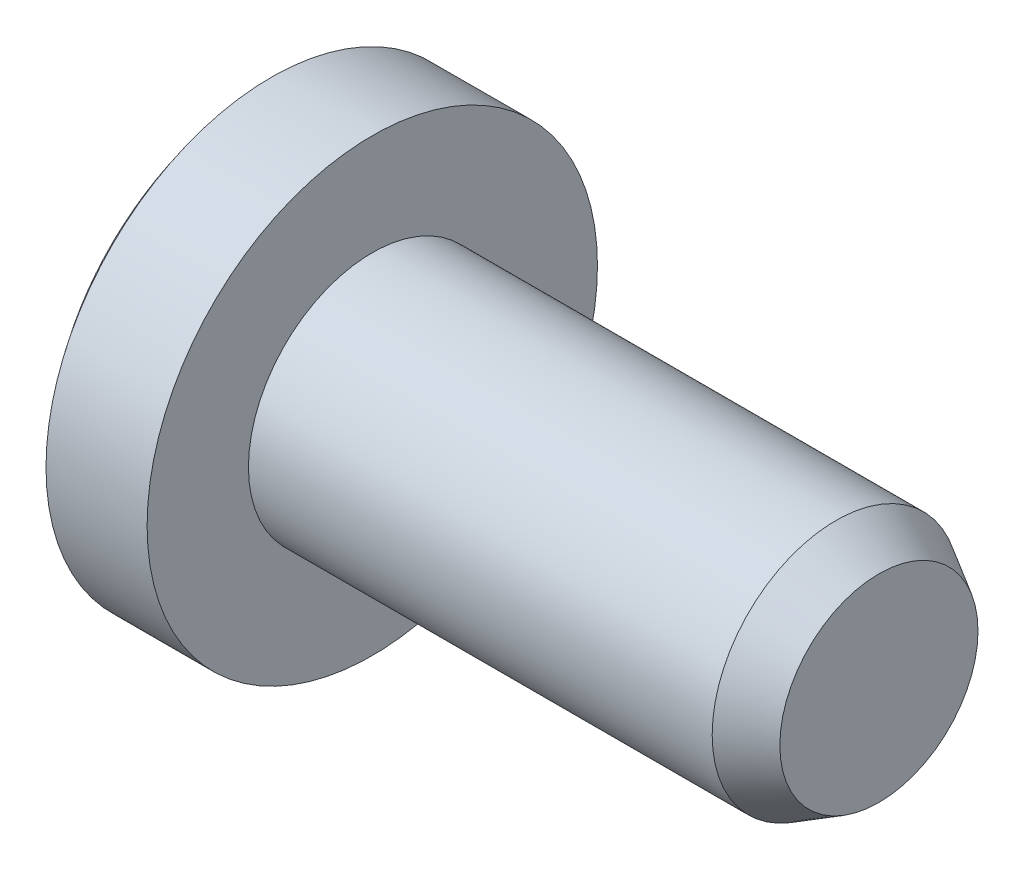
SolidWorks part; units mm, degrees
ref_plane "Front Plane" through (0, 0, 0) normal (0, 0, 1) x (1, 0, 0)
ref_plane "Top Plane" through (0, 0, 0) normal (0, 1, 0) x (1, 0, 0)
ref_plane "Right Plane" through (0, 0, 0) normal (1, 0, 0) x (0, 0, -1)
sketch "Sketch1" plane through (0, 0, 0) normal (0, 0, 1) x (1, 0, 0)
  line L0 (0, 0) -> (5.2282, 0) construction
  line L2 (0, 2) -> (-0.898, 2)
  line L3 (-1.6, 0) -> (-1.6, -0.7496) construction
  line L4 (-1.6, 0) -> (4.5, 0)
  line L5 (0, 1.1) -> (4.5, 1.1)
  line L6 (4.5, 1.1) -> (4.5, 0)
  line L7 (0, 1.1) -> (0, 2)
  arc A0 (-0.898, 2) -> (-1.6, 0) centre (1.6, 0) ccw
  dimension "rf" = 3.2
  dimension "Dk" = 4
  dimension "K" = 1.6
  dimension "l" = 4.5
  dimension "d" = 2.2
revolve "Revolve1" add sketch "Sketch1" angle 360 about L0
chamfer "Chamfer1" distance 0.22 angle 60 1 edges at (4.5, 0, 1.1)
sketch "Sketch5" plane through (0, 0, 0) normal (0, 0, 1) x (1, 0, 0)
  line L0 (0.3703, 0.825) -> (0.2069, 0.825)
  line L1 (0.2069, 0.825) -> (0.0481, 1.1)
  line L2 (0.3703, 0.825) -> (0.529, 1.1)
  line L3 (0.0481, 1.1) -> (0.0481, 1.35)
  line L4 (0.529, 1.1) -> (0.529, 1.35)
  line L5 (0.0481, 1.35) -> (0.529, 1.35)
  line L6 (0.2886, 0.825) -> (0.2886, 0) construction
  line L7 (0, 0) -> (7.3035, 0) construction
  line L9 (4.1189, 1.1) -> (0, 1.1) construction
  line L12 (0, -1.1) -> (0, 1.1) construction
  dimension "D2" = 60
  dimension "D3" = 0.25
  dimension "threadstart" = 0.2886
  dimension "minordia" = 1.65
  dimension "advance" = 0.4809
revolve "ThreadSchematic" [suppressed] cut sketch "Sketch5" angle 360 about L7
pattern_linear "ThdSchPat" [suppressed] count 10 spacing 0.4809 along (1, 0, 0)
sketch "Sketch2" plane through (0, 0, 0) normal (0, 0, 1) x (1, 0, 0)
  line L0 (0, 0) -> (5.7679, 0) construction
  line L1 (4.5, 0) -> (2.5947, 1.1)
  line L3 (4.5, 1.1) -> (4.5, 0) construction
  line L4 (2.5947, 1.1) -> (2.5947, 1.2)
  line L5 (2.5947, 1.2) -> (4.6, 1.2)
  line L6 (4.6, 1.2) -> (4.6, 0)
  line L7 (4.6, 0) -> (4.5, 0)
  point P9 (0, 1.1)
  dimension "D1" = 30
  dimension "D2" = 0.1
  dimension "D3" = 0.1
revolve "EndCone" [suppressed] cut sketch "Sketch2" angle 360 about L0
ref_plane "Plane4" through (-1.6, 0, 0) normal (1, 0, 0) x (0, 0, -1)
sketch "Sketch3" plane through (-1.6, 0, 0) normal (1, 0, 0) x (0, 0, -1)
  line L0 (0, 2.343) -> (0, -2.4842) construction
  line L1 (2.7661, 0) -> (-3.4558, 0) construction
  line L2 (-0.2375, 0.95) -> (0.2375, 0.95)
  line L3 (0.2375, 0.95) -> (0.1425, 0.57)
  line L4 (0, 0) -> (1.9578, 1.9578) construction
  line L5 (0.1425, 0.57) -> (0.299, 0.299)
  line L6 (0.1425, 0.57) -> (0, 0) construction
  line L7 (-0.1425, 0.57) -> (-0.299, 0.299)
  line L8 (-0.2375, 0.95) -> (-0.1425, 0.57)
  line L9 (0.95, 0.2375) -> (0.95, -0.2375)
  line L10 (0.95, -0.2375) -> (0.57, -0.1425)
  line L11 (0.57, -0.1425) -> (0.299, -0.299)
  line L12 (0.57, 0.1425) -> (0.299, 0.299)
  line L13 (0.95, 0.2375) -> (0.57, 0.1425)
  line L14 (0.2375, -0.95) -> (-0.2375, -0.95)
  line L15 (-0.2375, -0.95) -> (-0.1425, -0.57)
  line L16 (-0.1425, -0.57) -> (-0.299, -0.299)
  line L17 (0.1425, -0.57) -> (0.299, -0.299)
  line L18 (0.2375, -0.95) -> (0.1425, -0.57)
  line L19 (-0.95, -0.2375) -> (-0.95, 0.2375)
  line L20 (-0.95, 0.2375) -> (-0.57, 0.1425)
  line L21 (-0.57, 0.1425) -> (-0.299, 0.299)
  line L22 (-0.57, -0.1425) -> (-0.299, -0.299)
  line L23 (-0.95, -0.2375) -> (-0.57, -0.1425)
  point P14 (0, 0.95)
  point P23 (0.95, 0)
  point P30 (0, -0.95)
  point P37 (-0.95, 0)
  dimension "D1" = 45
  dimension "m" = 1.9
  dimension "D3" = 0.475
  dimension "D4" = 75
  dimension "D5" = 1.14
extrude "Cut-Extrude1" cut sketch "Sketch3" along normal blind 0.8 draft 6
sketch "Sketch4" plane through (-1.6, 0, 0) normal (1, 0, 0) x (0, 0, -1)
  line L0 (0, 2.1951) -> (0, -2.1951) construction
  line L1 (2.1996, 0) -> (-2.3835, 0) construction
  line L2 (-0.8397, -0.8397) -> (0.8397, 0.8397) construction
  line L3 (0.95, 0.2375) -> (-0.95, 0.2375)
  line L4 (0.95, 0.2375) -> (0.95, -0.2375)
  line L5 (0.95, -0.2375) -> (-0.95, -0.2375)
  line L6 (-0.95, 0.2375) -> (-0.95, -0.2375)
  line L7 (0.2375, 0.95) -> (-0.2375, 0.95)
  line L8 (0.2375, 0.95) -> (0.2375, -0.95)
  line L9 (0.2375, -0.95) -> (-0.2375, -0.95)
  line L10 (-0.2375, 0.95) -> (-0.2375, -0.95)
  line L11 (0.8397, 0.8397) -> (0.3859, 0.2375)
  line L12 (0.8397, 0.8397) -> (0.2375, 0.3859)
  line L13 (0.2375, 0.3859) -> (-0.2375, 0.3859) construction
  line L14 (0, 0) -> (-0.8397, 0.8397) construction
  line L15 (-0.8397, -0.8397) -> (-0.2375, -0.3859)
  line L16 (-0.8397, -0.8397) -> (-0.3859, -0.2375)
  line L17 (-0.2375, 0.3859) -> (-0.8397, 0.8397)
  line L18 (-0.8397, 0.8397) -> (-0.3859, 0.2375)
  line L19 (-0.3859, -0.2375) -> (-0.3859, 0.2375) construction
  line L20 (0.3859, -0.2375) -> (0.8397, -0.8397)
  line L21 (0.8397, -0.8397) -> (0.2375, -0.3859)
  circle A0 centre (0, 0) radius 1.1875 construction
  dimension "D1" = 2.375
  dimension "D2" = 0.475
  dimension "m" = 1.9
  dimension "D3" = 45
  dimension "D4" = 8
  dimension "D5" = 45
extrude "TypeZ" [suppressed] cut sketch "Sketch4" along normal blind 0.8
equation "\"D1@Chamfer1\" = \"d@Sketch1\"/10"
equation "\"D1@ThreadCosmetic\" = \"l@Sketch1\" - \"D1@Chamfer1\""
equation "\"minordia@sketch5\" = \"D2@ThreadCosmetic\""
equation "\"D1@Plane4\" = \"K@Sketch1\""
equation "\"D5@Sketch3\" = \"m@Sketch3\" * 3 / 5"
equation "\"D3@Sketch3\" = \"m@Sketch3\" / 4"
equation "\"D2@Sketch4\" =  \"m@Sketch4\" / 4"
equation "\"D1@TypeZ\" = \"K@Sketch1\" / 2"
equation "\"D1@Sketch4\" = \"m@Sketch4\" * 5 / 4"
equation "\"m@Sketch4\" = \"m@Sketch3\""
equation "\"threadstart@Sketch5\" = \"advance@Sketch5\"*0.6"
equation "\"D1@ThdSchPat\" = int((\"l@Sketch1\"/\"advance@Sketch5\") + 0.999)"
equation "\"D3@ThdSchPat\" = \"advance@Sketch5\""
